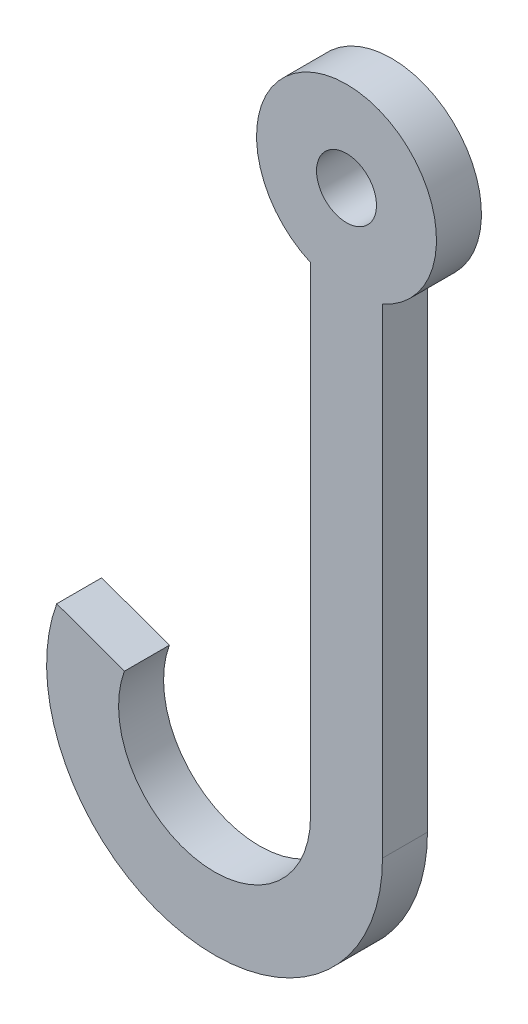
SolidWorks part; units mm, degrees
ref_plane "Front Plane" through (0, 0, 0) normal (0, 0, 1) x (1, 0, 0)
ref_plane "Top Plane" through (0, 0, 0) normal (0, 1, 0) x (1, 0, 0)
ref_plane "Right Plane" through (0, 0, 0) normal (1, 0, 0) x (0, 0, -1)
sketch "Sketch1" plane through (0, 0, 0) normal (0, 0, 1) x (1, 0, 0)
  line L0 (-3.81, -8.7298) -> (-3.81, -59.5298)
  line L1 (-23.5173, -56.0549) -> (-30.6777, -53.4487)
  line L2 (3.81, -8.7298) -> (3.81, -59.5298)
  line L3 (-3.81, -59.5298) -> (3.81, -59.5298) construction
  circle A0 centre (0, 0) radius 3.175
  arc A1 (3.81, -8.7298) -> (-3.81, -8.7298) centre (0, 0) ccw
  arc A2 (-3.81, -59.5298) -> (-23.5173, -56.0549) centre (-13.97, -59.5298) cw
  arc A3 (-30.6777, -53.4487) -> (3.81, -59.5298) centre (-13.97, -59.5298) ccw
  arc A4 (-3.81, -8.7298) -> (3.81, -8.7298) centre (0, 0) ccw construction
  point P10 (0, -59.5298)
  dimension "D1" = 6.35
  dimension "D2" = 19.05
  dimension "D6" = 10.16
  dimension "D3" = 50.8
  dimension "D4" = 7.62
  dimension "D5" = 20
extrude "Boss-Extrude1" add sketch "Sketch1" along normal blind 4.7625 contours L2 A3 L1 A2 L0 A1
